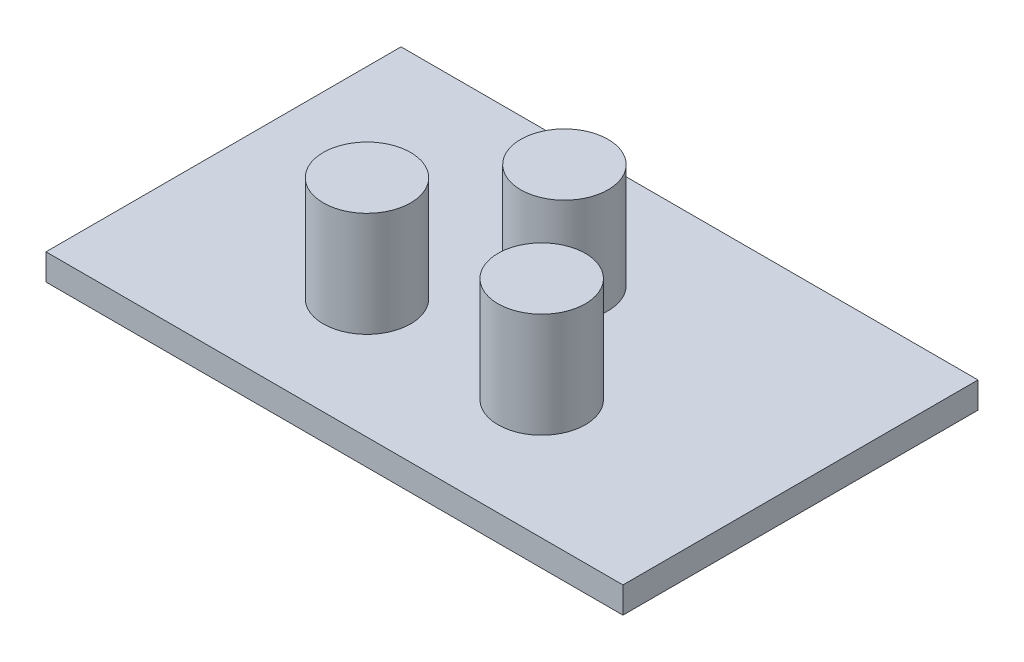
SolidWorks part; units mm, degrees
ref_plane "Front Plane" through (0, 0, 0) normal (0, 0, 1) x (1, 0, 0)
ref_plane "Top Plane" through (0, 0, 0) normal (0, 1, 0) x (1, 0, 0)
ref_plane "Right Plane" through (0, 0, 0) normal (1, 0, 0) x (0, 0, -1)
sketch "Sketch1" plane through (0, 0, 0) normal (0, 1, 0) x (1, 0, 0)
  line L1 (16.51, -10.16) -> (-16.51, -10.16)
  line L2 (16.51, -10.16) -> (16.51, 10.16)
  line L3 (16.51, 10.16) -> (-16.51, 10.16)
  line L4 (-16.51, -10.16) -> (-16.51, 10.16)
  line L5 (16.51, -10.16) -> (-16.51, 10.16) construction
  line L6 (16.51, 10.16) -> (-16.51, -10.16) construction
  point P0 (0, 0)
  dimension "D1" = 33.02
  dimension "D2" = 20.32
extrude "Boss-Extrude1" add sketch "Sketch1" along normal blind 1.5
sketch "Sketch2" plane through (0, 1.5, 0) normal (0, 1, 0) x (1, 0, 0)
  line L0 (-5, -3.3) -> (5, -3.3) construction
  circle A0 centre (0, 3) radius 2.5
  circle A1 centre (-5, -3.3) radius 2.5
  circle A2 centre (5, -3.3) radius 2.5
  point P6 (0, -3.3)
  dimension "D1" = 5
  dimension "D2" = 10
  dimension "D3" = 3
  dimension "D4" = 3.3
extrude "Boss-Extrude2" add sketch "Sketch2" along normal blind 6
